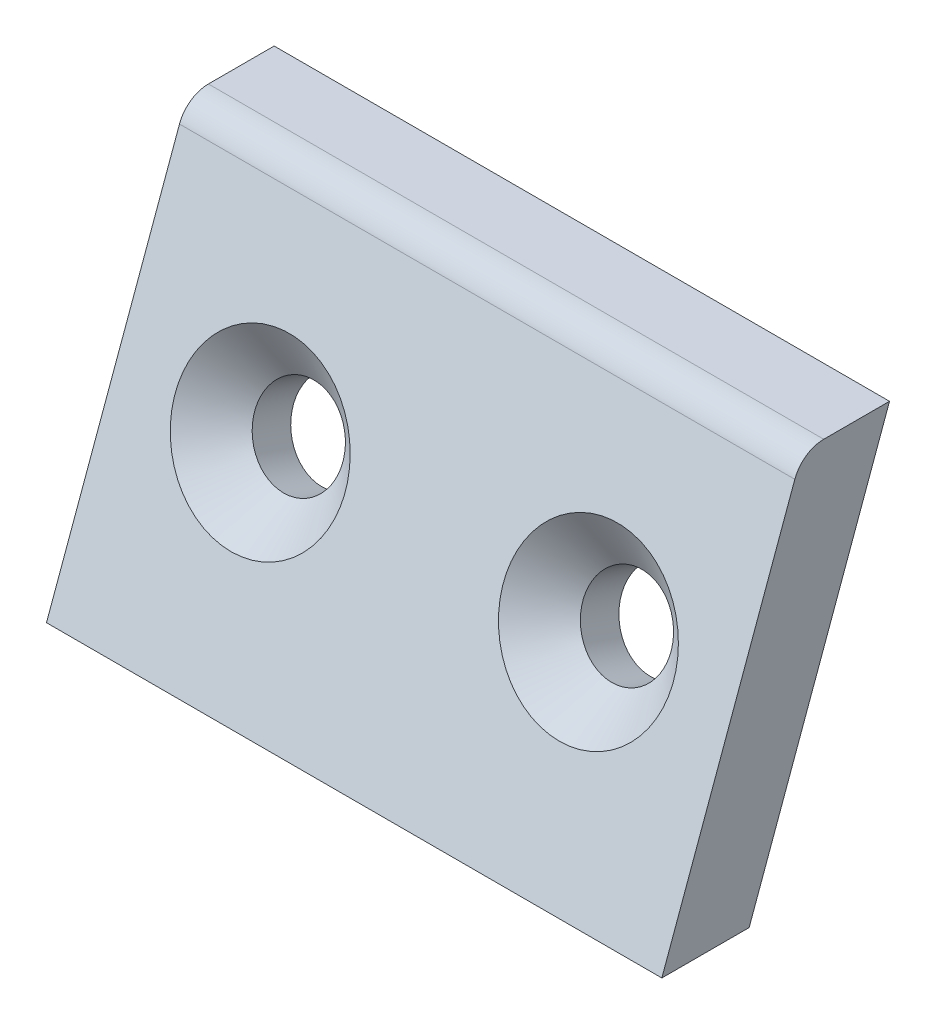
SolidWorks part; units mm, degrees
ref_plane "Plan de face" through (0, 0, 0) normal (0, 0, 1) x (1, 0, 0)
ref_plane "Plan de dessus" through (0, 0, 0) normal (0, 1, 0) x (1, 0, 0)
ref_plane "Plan de droite" through (0, 0, 0) normal (1, 0, 0) x (0, 0, -1)
sketch "Esquisse1" plane through (0, 0, 0) normal (1, 0, 0) x (0, 0, -1)
  line L0 (0, 0) -> (6.4834, 17.813)
  line L1 (7.893, 18.8) -> (11.0994, 18.8)
  line L2 (11.0994, 18.8) -> (4.2567, 0)
  line L3 (4.2567, 0) -> (0, 0)
  line L4 (0, 0) -> (0, 64.1523) construction
  arc A0 (6.4834, 17.813) -> (7.893, 18.8) centre (7.893, 17.3) cw
  dimension "D4" = 1.5
  dimension "D1" = 20
  dimension "D2" = 18.8
  dimension "D3" = 4
extrude "Boss.-Extru.1" add sketch "Esquisse1" along normal blind 30
hole_wizard "Fraisage pour vis à tête fraisée M21" positions "Esquisse4" profile "Esquisse3" countersink size "M2" standard "ISO"
sketch "Esquisse4" plane through (0, 0, 0) normal (0, 0.342, 0.9397) x (1, 0, 0)
  line L0 (0, 18.9562) -> (0, 0) construction
  line L3 (30, 0) -> (0, 0) construction
  point P0 (7, 10)
  point P1 (23, 10)
  point P10 (7.24, 0)
  point P17 (2.2683, 0)
  dimension "D1" = 7
  dimension "D2" = 10
  dimension "D3" = 16
  dimension "D4" = 10
sketch "Esquisse3" plane through (7, 9.3969, -3.4202) normal (1, 0, 0) x (0, -0.9397, 0.342)
  line L0 (0, 0) -> (0, 10.43)
  line L1 (0, 10.43) -> (2.15, 10.43)
  line L2 (2.15, 10.43) -> (2.15, 2)
  line L3 (2.15, 2) -> (4.15, 0)
  line L5 (4.15, 0) -> (0, 0)
  line L6 (-2.15, 2) -> (-4.15, 0) construction
  line L11 (0, -6.35) -> (0, 107.95) construction
  dimension "Diamètre du perçage jusqu'au prochain" = 4.3
  dimension "Profondeur du perçage jusqu'au prochain" = 10.43
  dimension "Diamètre du fraisage entrant" = 8.3
  dimension "Angle du fraisage entrant" = 90
